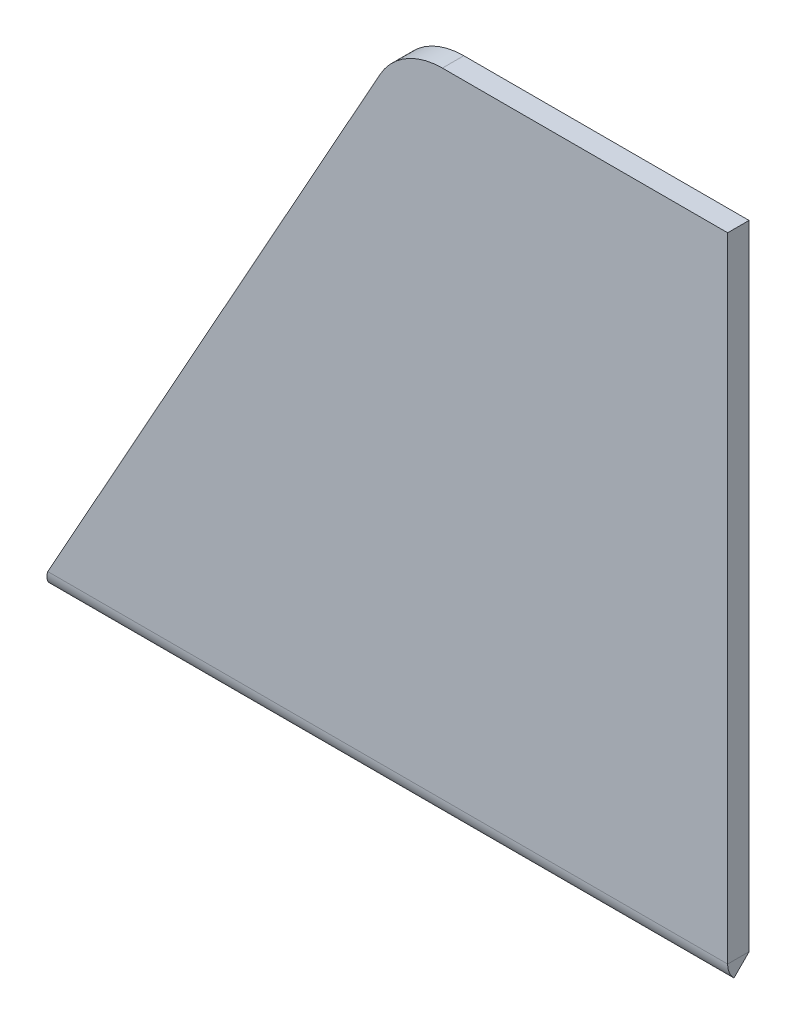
SolidWorks part; units mm, degrees
ref_plane "Front" through (0, 0, 0) normal (0, 0, 1) x (1, 0, 0)
ref_plane "Top" through (0, 0, 0) normal (0, 1, 0) x (1, 0, 0)
ref_plane "Right" through (0, 0, 0) normal (1, 0, 0) x (0, 0, -1)
sketch "Sketch1" plane through (0, 0, 0) normal (0, 0, 1) x (1, 0, 0)
  line L0 (30, 0) -> (48, 0)
  line L1 (48, 0) -> (48, 45)
  line L3 (48, 45) -> (28, 45)
  line L5 (0, -10) -> (30, -10)
  line L6 (30, -10) -> (30, 0)
  line L7 (0, -10) -> (0, 0)
  line L12 (0, 0) -> (23.6318, 42.4328)
  arc A0 (28, 45) -> (23.6318, 42.4328) centre (28, 40) ccw
  circle A1 centre (8, -5) radius 1.75
  circle A2 centre (22, -5) radius 1.75
sheet metal parameters "Sheet-Metal1" thickness 1.5 parameters "D1"=0.01
base flange "Base-Flange1" sketch "Sketch1" thickness 1.5 reverse thickness direction yes parameters "D1"=0.01
sketch "Sketch3" plane through (0, 0, 1.5) normal (0, 0, 1) x (1, 0, 0)
  line L0 (30, 0) -> (0, 0)
sketched bend "Sketched Bend1" parameters "D1"=0.01
bend "SketchBend1" bend radius 0.01 bend angle 90 parameters "D5"=1
flat pattern "Flat-Pattern1"
sketch "Bend-Lines1" plane through (0, 0, 1.5) normal (0, 0, 1) x (1, 0, 0)
  line L0 (48, 0) -> (0, 0) construction
bend of the flat pattern "Flatten-<SketchBend1>1"
